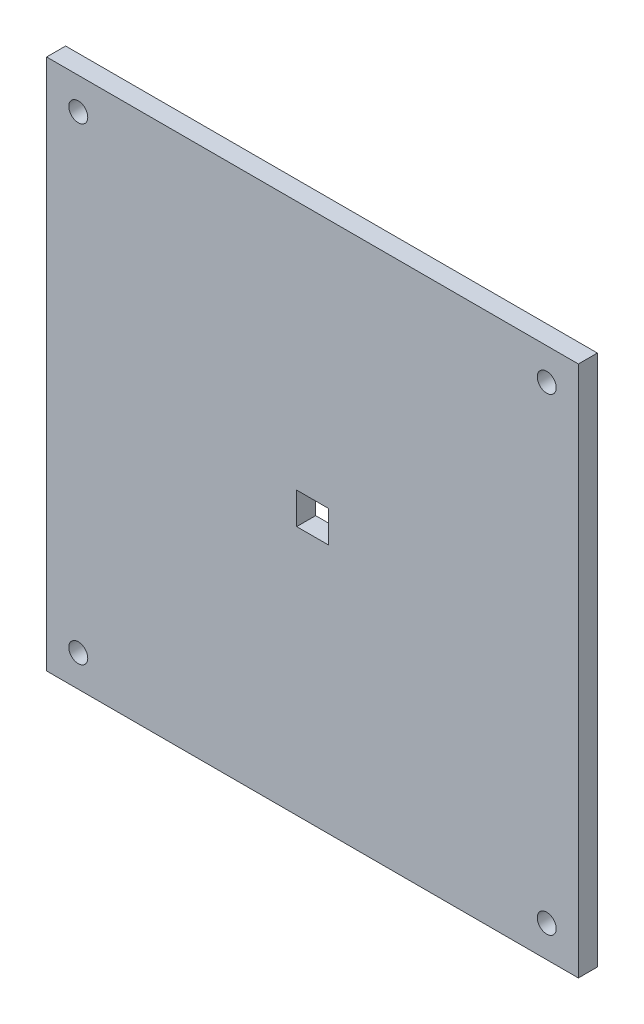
SolidWorks part; units mm, degrees
ref_plane "Piano frontale" through (0, 0, 0) normal (0, 0, 1) x (1, 0, 0)
ref_plane "Piano superiore" through (0, 0, 0) normal (0, 1, 0) x (1, 0, 0)
ref_plane "Piano destro" through (0, 0, 0) normal (1, 0, 0) x (0, 0, -1)
sketch "Sketch1" plane through (0, 0, 0) normal (0, 0, 1) x (1, 0, 0)
  line L1 (-42, 42) -> (42, 42)
  line L2 (-42, 42) -> (-42, -42)
  line L3 (-42, -42) -> (42, -42)
  line L4 (42, 42) -> (42, -42)
  line L5 (-42, 42) -> (42, -42) construction
  line L6 (-42, -42) -> (42, 42) construction
  line L7 (-2.5, 2.5) -> (2.5, 2.5)
  line L8 (-2.5, 2.5) -> (-2.5, -2.5)
  line L9 (-2.5, -2.5) -> (2.5, -2.5)
  line L10 (2.5, 2.5) -> (2.5, -2.5)
  line L11 (-2.5, 2.5) -> (2.5, -2.5) construction
  line L12 (-2.5, -2.5) -> (2.5, 2.5) construction
  circle A0 centre (-37, 37) radius 1.5
  circle A1 centre (37, 37) radius 1.5
  circle A2 centre (37, -37) radius 1.5
  circle A3 centre (-37, -37) radius 1.5
  point P0 (0, 0)
  point P6 (0, 0)
  point P22 (0, 0)
  dimension "D6" = 3
  dimension "D1" = 84
  dimension "D2" = 84
  dimension "D3" = 5
  dimension "D4" = 5
  dimension "D5" = 5
  dimension "D7" = 4
extrude "Boss-Extrude1" add sketch "Sketch1" along normal blind 3
